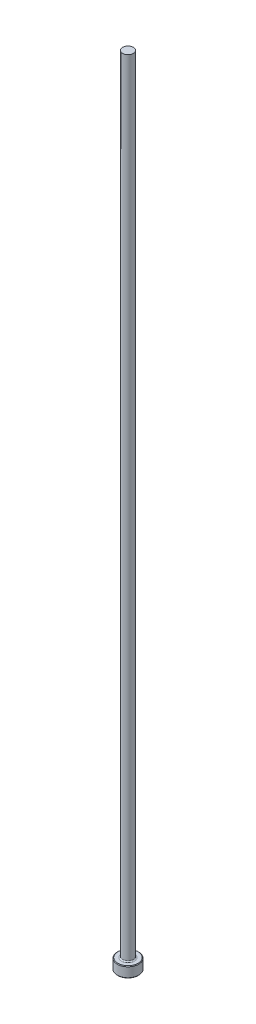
SolidWorks part; units mm, degrees
ref_plane "Front Plane" through (0, 0, 0) normal (0, 0, 1) x (1, 0, 0)
ref_plane "Top Plane" through (0, 0, 0) normal (0, 1, 0) x (1, 0, 0)
ref_plane "Right Plane" through (0, 0, 0) normal (1, 0, 0) x (0, 0, -1)
sketch "Sketch1" plane through (0, 0, 0) normal (0, 0, 1) x (1, 0, 0)
  line L0 (0, 259.9588) -> (0, -15.1925) construction
  line L1 (0, 0) -> (-4.7625, 0)
  line L2 (-4.7625, 0) -> (-4.7625, 4.7498)
  line L3 (-4.7625, 4.7498) -> (-2.3812, 4.7498)
  line L4 (-2.3812, 4.7498) -> (-2.3812, 355.6)
  line L5 (-2.3812, 355.6) -> (0, 355.6)
  line L6 (0, 355.6) -> (0, 0)
  dimension "L" = 355.6
  dimension "H" = 9.525
  dimension "T" = 4.7498
  dimension "D" = 4.7625
revolve "Revolve1" add sketch "Sketch1" angle 360 about L0
chamfer "Chamfer1" distance 0.254 angle 45 2 edges at (0, 4.7498, 4.7625) (0, 0, 4.7625)
fillet "Fillet1" radius 0.508 1 edges at (0, 4.7498, 2.3812)
sketch "Pocket Sketch" plane through (0, 0, 0) normal (0, 0, 1) x (1, 0, 0)
  line L0 (-5.1594, 0) -> (-5.1594, 4.7752)
  line L1 (-5.1594, 4.7752) -> (-3.3417, 4.7752)
  line L2 (-2.5797, 5.5372) -> (-2.5797, 22.225)
  line L3 (-2.5797, 22.225) -> (0, 22.225)
  line L4 (0, 22.225) -> (0, 0)
  line L5 (0, 0) -> (-5.1594, 0)
  line L6 (0, 12.6104) -> (0, -2.4989) construction
  line L7 (-4.7625, 4.4958) -> (-4.7625, 0.254) construction
  line L8 (4.5085, 4.7498) -> (-4.5085, 4.7498) construction
  line L9 (-2.3812, 355.6) -> (-2.3812, 5.2578) construction
  line L10 (-3.3417, 4.7752) -> (-2.5797, 5.5372)
  point P3 (-2.5797, 4.7752)
  dimension "D1" = 10.3187
  dimension "D2" = 0.3969
  dimension "D3" = 0.0254
  dimension "D4" = 0.1984
  dimension "D5" = 5.1594
  dimension "D6" = 22.225
